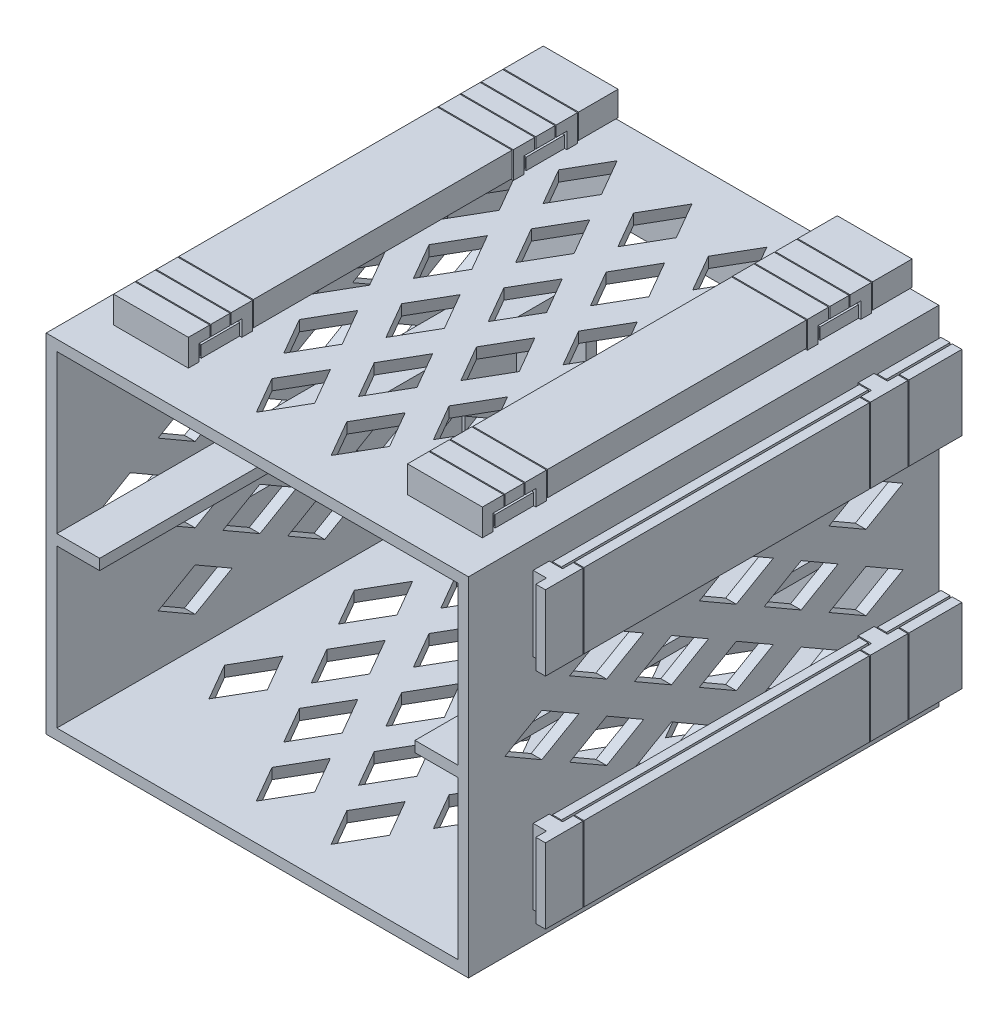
SolidWorks part; units mm, degrees
ref_plane "Alzado" through (0, 0, 0) normal (0, 0, 1) x (1, 0, 0)
ref_plane "Planta" through (0, 0, 0) normal (0, 1, 0) x (1, 0, 0)
ref_plane "Vista lateral" through (0, 0, 0) normal (1, 0, 0) x (0, 0, -1)
sketch "Croquis1" plane through (0, 0, 0) normal (0, 0, -1) x (-1, 0, 0)
  line L1 (-39.5, 32.5) -> (39.5, 32.5)
  line L2 (-39.5, 32.5) -> (-39.5, -32.5)
  line L3 (-39.5, -32.5) -> (39.5, -32.5)
  line L4 (39.5, 32.5) -> (39.5, -32.5)
  line L7 (-24.5, 17.5) -> (24.5, 17.5)
  line L8 (-24.5, 17.5) -> (-24.5, -17.5)
  line L9 (-24.5, -17.5) -> (24.5, -17.5)
  line L10 (24.5, 17.5) -> (24.5, -17.5)
extrude "Fondo" add sketch "Croquis1" against normal blind 2 separate body
sketch "Croquis3" plane through (0, 0, 2) normal (0, 0, 1) x (1, 0, 0)
  line L1 (-39.5, 32.5) -> (39.5, 32.5)
  line L2 (-39.5, 32.5) -> (-39.5, -32.5)
  line L3 (-39.5, -32.5) -> (39.5, -32.5)
  line L4 (39.5, 32.5) -> (39.5, -32.5)
  line L6 (-37.5, 30.5) -> (-37.5, -30.5)
  line L7 (-37.5, 30.5) -> (37.5, 30.5)
  line L8 (37.5, 30.5) -> (37.5, -30.5)
  line L9 (-37.5, -30.5) -> (37.5, -30.5)
extrude "Estructura" add sketch "Croquis3" along normal blind 86
sketch "Croquis5" plane through (-39.5, 0, 0) normal (-1, 0, 0) x (0, 0, 1)
  line L0 (13.628, 25) -> (20.556, 21)
  line L1 (20.556, 21) -> (13.628, 17)
  line L2 (13.628, 17) -> (6.7, 21)
  line L3 (6.7, 21) -> (13.628, 25)
  line L4 (0, -32.5) -> (0, 32.5) construction
  line L5 (88, 32.5) -> (0, 32.5) construction
  line L6 (13.628, 11) -> (20.556, 7)
  line L7 (6.7, 7) -> (13.628, 11)
  line L8 (13.628, 3) -> (6.7, 7)
  line L9 (20.556, 7) -> (13.628, 3)
  line L10 (13.628, -3) -> (20.556, -7)
  line L11 (6.7, -7) -> (13.628, -3)
  line L12 (13.628, -11) -> (6.7, -7)
  line L13 (20.556, -7) -> (13.628, -11)
  line L14 (13.628, -17) -> (20.556, -21)
  line L15 (6.7, -21) -> (13.628, -17)
  line L16 (13.628, -25) -> (6.7, -21)
  line L17 (20.556, -21) -> (13.628, -25)
  line L18 (37.884, 25) -> (44.812, 21)
  line L19 (44.812, 21) -> (37.884, 17)
  line L20 (37.884, 17) -> (30.956, 21)
  line L21 (30.956, 21) -> (37.884, 25)
  line L22 (44.812, 7) -> (37.884, 3)
  line L23 (37.884, 11) -> (44.812, 7)
  line L24 (30.956, 7) -> (37.884, 11)
  line L25 (37.884, 3) -> (30.956, 7)
  line L26 (44.812, -7) -> (37.884, -11)
  line L27 (37.884, -3) -> (44.812, -7)
  line L28 (30.956, -7) -> (37.884, -3)
  line L29 (37.884, -11) -> (30.956, -7)
  line L30 (37.884, -17) -> (44.812, -21)
  line L31 (44.812, -21) -> (37.884, -25)
  line L32 (37.884, -25) -> (30.956, -21)
  line L33 (30.956, -21) -> (37.884, -17)
  line L34 (62.14, 25) -> (69.068, 21)
  line L35 (69.068, 21) -> (62.14, 17)
  line L36 (62.14, 17) -> (55.212, 21)
  line L37 (55.212, 21) -> (62.14, 25)
  line L38 (69.068, 7) -> (62.14, 3)
  line L39 (62.14, 11) -> (69.068, 7)
  line L40 (55.212, 7) -> (62.14, 11)
  line L41 (62.14, 3) -> (55.212, 7)
  line L42 (69.068, -7) -> (62.14, -11)
  line L43 (62.14, -3) -> (69.068, -7)
  line L44 (55.212, -7) -> (62.14, -3)
  line L45 (62.14, -11) -> (55.212, -7)
  line L46 (62.14, -17) -> (69.068, -21)
  line L47 (69.068, -21) -> (62.14, -25)
  line L48 (62.14, -25) -> (55.212, -21)
  line L49 (55.212, -21) -> (62.14, -17)
  line L66 (50.012, 18) -> (56.94, 14)
  line L67 (56.94, 14) -> (50.012, 10)
  line L68 (50.012, 10) -> (43.084, 14)
  line L69 (43.084, 14) -> (50.012, 18)
  line L70 (50.012, 4) -> (56.94, 0)
  line L71 (43.084, 0) -> (50.012, 4)
  line L72 (50.012, -4) -> (43.084, 0)
  line L73 (56.94, -14) -> (50.012, -18)
  line L74 (50.012, -10) -> (56.94, -14)
  line L75 (43.084, -14) -> (50.012, -10)
  line L76 (18.828, 14) -> (25.756, 18)
  line L77 (67.34, 14) -> (74.268, 18) construction
  line L78 (67.34, -14) -> (74.268, -10) construction
  line L79 (74.268, -18) -> (67.34, -14) construction
  line L80 (25.756, 4) -> (32.684, 0)
  line L81 (18.828, 0) -> (25.756, 4)
  line L82 (25.756, -4) -> (18.828, 0)
  line L83 (32.684, 0) -> (25.756, -4)
  line L84 (25.756, -18) -> (18.828, -14)
  line L85 (32.684, -14) -> (25.756, -18)
  line L86 (56.94, 0) -> (50.012, -4)
  line L87 (50.012, -18) -> (43.084, -14)
  line L88 (32.684, 14) -> (25.756, 10)
  line L89 (25.756, 10) -> (18.828, 14)
  line L90 (25.756, 18) -> (32.684, 14)
  line L91 (74.268, 18) -> (81.196, 14) construction
  line L92 (81.196, 14) -> (74.268, 10) construction
  line L93 (74.268, 10) -> (67.34, 14) construction
  line L94 (81.196, 0) -> (74.268, -4)
  line L95 (74.268, 4) -> (81.196, 0)
  line L96 (67.34, 0) -> (74.268, 4)
  line L97 (74.268, -4) -> (67.34, 0)
  line L98 (81.196, -14) -> (74.268, -18) construction
  line L99 (74.268, -10) -> (81.196, -14) construction
  line L100 (25.756, -10) -> (32.684, -14)
  line L101 (18.828, -14) -> (25.756, -10)
  line L102 (88, 32.5) -> (0, 32.5) construction
  line L103 (86.396, 25) -> (93.324, 21)
  line L104 (93.324, 21) -> (86.396, 17)
  line L105 (86.396, 17) -> (79.468, 21)
  line L106 (79.468, 21) -> (86.396, 25)
  line L107 (93.324, 7) -> (86.396, 3)
  line L108 (86.396, 11) -> (93.324, 7)
  line L109 (79.468, 7) -> (86.396, 11)
  line L110 (86.396, 3) -> (79.468, 7)
  line L111 (93.324, -7) -> (86.396, -11)
  line L112 (86.396, -3) -> (93.324, -7)
  line L113 (79.468, -7) -> (86.396, -3)
  line L114 (86.396, -11) -> (79.468, -7)
  line L115 (86.396, -17) -> (93.324, -21)
  line L116 (93.324, -21) -> (86.396, -25)
  line L117 (86.396, -25) -> (79.468, -21)
  line L118 (79.468, -21) -> (86.396, -17)
  dimension "D1" = 7.9998
  dimension "D2" = 7.9998
  dimension "D3" = 6.7
  dimension "D4" = 7.5
  dimension "D5" = 8
  dimension "D7" = 13.856
  dimension "D9" = 24.256
  dimension "D10" = 14.5
  dimension "D11" = 24.256
  dimension "D6" = 4
  dimension "D8" = 4
extrude "RombosHor" cut sketch "Croquis5" against normal up to surface (79 mm away)
sketch "Croquis9" plane through (0, 32.5, 0) normal (0, 1, 0) x (1, 0, 0)
  line L0 (28, -6.6872) -> (24, -13.6154)
  line L1 (28, -6.6872) -> (32, -13.6154)
  line L2 (24, -13.6154) -> (28, -20.5436)
  line L3 (32, -13.6154) -> (28, -20.5436)
  line L4 (14, -6.6872) -> (10, -13.6154)
  line L5 (14, -6.6872) -> (18, -13.6154)
  line L6 (18, -13.6154) -> (14, -20.5436)
  line L7 (10, -13.6154) -> (14, -20.5436)
  line L8 (0, -6.6872) -> (-4, -13.6154)
  line L9 (0, -6.6872) -> (4, -13.6154)
  line L10 (4, -13.6154) -> (0, -20.5436)
  line L11 (-4, -13.6154) -> (0, -20.5436)
  line L12 (-14, -6.6872) -> (-18, -13.6154)
  line L13 (-14, -6.6872) -> (-10, -13.6154)
  line L14 (-10, -13.6154) -> (-14, -20.5436)
  line L15 (-18, -13.6154) -> (-14, -20.5436)
  line L16 (-28, -6.6872) -> (-32, -13.6154)
  line L17 (-28, -6.6872) -> (-24, -13.6154)
  line L18 (-24, -13.6154) -> (-28, -20.5436)
  line L19 (-32, -13.6154) -> (-28, -20.5436)
  line L20 (14, -30.9436) -> (10, -37.8718)
  line L21 (14, -30.9436) -> (18, -37.8718)
  line L22 (18, -37.8718) -> (14, -44.8)
  line L23 (10, -37.8718) -> (14, -44.8)
  line L24 (0, -30.9436) -> (-4, -37.8718)
  line L25 (0, -30.9436) -> (4, -37.8718)
  line L26 (4, -37.8718) -> (0, -44.8)
  line L27 (-4, -37.8718) -> (0, -44.8)
  line L28 (-14, -30.9436) -> (-18, -37.8718)
  line L29 (-14, -30.9436) -> (-10, -37.8718)
  line L30 (-10, -37.8718) -> (-14, -44.8)
  line L31 (-18, -37.8718) -> (-14, -44.8)
  line L32 (-28, -30.9436) -> (-32, -37.8718)
  line L33 (-28, -30.9436) -> (-24, -37.8718)
  line L34 (-24, -37.8718) -> (-28, -44.8)
  line L35 (-32, -37.8718) -> (-28, -44.8)
  line L36 (14, -55.2) -> (10, -62.1282)
  line L37 (14, -55.2) -> (18, -62.1282)
  line L38 (18, -62.1282) -> (14, -69.0564)
  line L39 (10, -62.1282) -> (14, -69.0564)
  line L40 (0, -55.2) -> (-4, -62.1282)
  line L41 (0, -55.2) -> (4, -62.1282)
  line L42 (4, -62.1282) -> (0, -69.0564)
  line L43 (-4, -62.1282) -> (0, -69.0564)
  line L44 (-14, -55.2) -> (-18, -62.1282)
  line L45 (-14, -55.2) -> (-10, -62.1282)
  line L46 (-10, -62.1282) -> (-14, -69.0564)
  line L47 (-18, -62.1282) -> (-14, -69.0564)
  line L48 (-28, -55.2) -> (-32, -62.1282)
  line L49 (-28, -55.2) -> (-24, -62.1282)
  line L50 (-24, -62.1282) -> (-28, -69.0564)
  line L51 (-32, -62.1282) -> (-28, -69.0564)
  line L68 (28, -30.9436) -> (24, -37.8718)
  line L69 (28, -30.9436) -> (32, -37.8718)
  line L70 (32, -37.8718) -> (28, -44.8)
  line L71 (24, -37.8718) -> (28, -44.8)
  line L72 (28, -55.2) -> (24, -62.1282)
  line L73 (28, -55.2) -> (32, -62.1282)
  line L74 (32, -62.1282) -> (28, -69.0564)
  line L75 (24, -62.1282) -> (28, -69.0564)
  line L80 (28, -6.6872) -> (14, -6.6872) construction
  line L81 (28, -6.6872) -> (28, -30.9436) construction
  line L83 (39.5, -88) -> (39.5, 0) construction
  line L87 (-39.5, 0) -> (39.5, 0) construction
  line L88 (17, -50.0018) -> (21, -56.93)
  line L89 (7, -67.33) -> (11, -74.2582)
  line L90 (-7, -67.33) -> (-11, -74.2582)
  line L91 (-7, -67.33) -> (-3, -74.2582)
  line L92 (-3, -74.2582) -> (-7, -81.1864)
  line L93 (-21, -67.33) -> (-25, -74.2582) construction
  line L94 (-21, -67.33) -> (-17, -74.2582) construction
  line L95 (-25, -74.2582) -> (-21, -81.1864) construction
  line L96 (21, -67.33) -> (25, -74.2582) construction
  line L97 (25, -74.2582) -> (21, -81.1864) construction
  line L98 (17, -74.2582) -> (21, -81.1864) construction
  line L99 (7, -18.8172) -> (3, -25.7454)
  line L100 (17, -25.7454) -> (21, -32.6736)
  line L101 (21, -18.8172) -> (25, -25.7454)
  line L102 (-7, -43.0736) -> (-11, -50.0018)
  line L103 (-3, -50.0018) -> (-7, -56.93)
  line L104 (-21, -43.0736) -> (-25, -50.0018)
  line L105 (-21, -43.0736) -> (-17, -50.0018)
  line L106 (-3, -25.7454) -> (-7, -32.6736)
  line L107 (-11, -25.7454) -> (-7, -32.6736)
  line L108 (-21, -18.8172) -> (-17, -25.7454)
  line L109 (-21, -18.8172) -> (-25, -25.7454)
  line L110 (-25, -25.7454) -> (-21, -32.6736)
  line L111 (21, -43.0736) -> (17, -50.0018)
  line L112 (11, -25.7454) -> (7, -32.6736)
  line L113 (7, -18.8172) -> (11, -25.7454)
  line L114 (7, -67.33) -> (3, -74.2582)
  line L115 (11, -74.2582) -> (7, -81.1864)
  line L116 (3, -74.2582) -> (7, -81.1864)
  line L117 (-11, -74.2582) -> (-7, -81.1864)
  line L118 (-17, -74.2582) -> (-21, -81.1864) construction
  line L119 (21, -67.33) -> (17, -74.2582) construction
  line L120 (7, -43.0736) -> (3, -50.0018)
  line L121 (7, -43.0736) -> (11, -50.0018)
  line L122 (11, -50.0018) -> (7, -56.93)
  line L123 (3, -50.0018) -> (7, -56.93)
  line L124 (21, -43.0736) -> (25, -50.0018)
  line L125 (25, -50.0018) -> (21, -56.93)
  line L126 (21, -18.8172) -> (17, -25.7454)
  line L127 (-7, -43.0736) -> (-3, -50.0018)
  line L128 (-11, -50.0018) -> (-7, -56.93)
  line L129 (-17, -50.0018) -> (-21, -56.93)
  line L130 (-25, -50.0018) -> (-21, -56.93)
  line L131 (-7, -18.8172) -> (-11, -25.7454)
  line L132 (-7, -18.8172) -> (-3, -25.7454)
  line L133 (-17, -25.7454) -> (-21, -32.6736)
  line L134 (3, -25.7454) -> (7, -32.6736)
  line L135 (25, -25.7454) -> (21, -32.6736)
  line L136 (18, -86.3846) -> (14, -93.3128)
  line L137 (10, -86.3846) -> (14, -93.3128)
  line L138 (4, -86.3846) -> (0, -93.3128)
  line L139 (-4, -86.3846) -> (0, -93.3128)
  line L140 (-10, -86.3846) -> (-14, -93.3128)
  line L141 (-18, -86.3846) -> (-14, -93.3128)
  line L142 (-24, -86.3846) -> (-28, -93.3128)
  line L143 (-32, -86.3846) -> (-28, -93.3128)
  line L144 (32, -86.3846) -> (28, -93.3128)
  line L145 (24, -86.3846) -> (28, -93.3128)
  line L146 (14, -79.4564) -> (10, -86.3846)
  line L147 (14, -79.4564) -> (18, -86.3846)
  line L148 (0, -79.4564) -> (-4, -86.3846)
  line L149 (0, -79.4564) -> (4, -86.3846)
  line L150 (-14, -79.4564) -> (-18, -86.3846)
  line L151 (-14, -79.4564) -> (-10, -86.3846)
  line L152 (-28, -79.4564) -> (-32, -86.3846)
  line L153 (-28, -79.4564) -> (-24, -86.3846)
  line L154 (28, -79.4564) -> (24, -86.3846)
  line L155 (28, -79.4564) -> (32, -86.3846)
  dimension "D1" = 8
  dimension "D2" = 8
  dimension "D3" = 8
  dimension "D4" = 13.8564
  dimension "D7" = 14
  dimension "D8" = 24.2564
  dimension "D9" = 6.6872
  dimension "D10" = 7.5
  dimension "D5" = 5
  dimension "D6" = 4
extrude "RombosVert" cut sketch "Croquis9" against normal up to surface (65 mm away)
sketch "Croquis8" plane through (0, 0, 2) normal (0, 0, 1) x (1, 0, 0)
  line L0 (-37.5, -30.5) -> (37.5, -30.5) construction
  line L1 (-29.5, -1) -> (-37.5, -1)
  line L2 (-29.5, -1) -> (-29.5, 1)
  line L3 (-29.5, 1) -> (-37.5, 1)
  line L4 (-37.5, -1) -> (-37.5, 1)
  line L5 (29.5, 1) -> (37.5, 1)
  line L6 (29.5, 1) -> (29.5, -1)
  line L7 (29.5, -1) -> (37.5, -1)
  line L8 (37.5, 1) -> (37.5, -1)
  dimension "D1" = 8
  dimension "D2" = 2
  dimension "D3" = 29.5
extrude "Guias" add sketch "Croquis8" along normal blind 86
sketch "Croquis10" plane through (39.5, 0, 0) normal (1, 0, 0) x (0, 0, -1)
  line L0 (-88, 32.5) -> (0, 32.5) construction
  line L1 (-12.104, -27.5) -> (-12.104, -13.5)
  line L2 (-15.104, -13.5) -> (-12.104, -13.5)
  line L3 (-15.104, -27.5) -> (-15.104, -13.5)
  line L4 (-15.104, -27.5) -> (-12.104, -27.5)
  line L5 (-88, 0) -> (0, 0) construction
  line L6 (-75.896, 27.5) -> (-75.896, 13.5)
  line L7 (-72.896, 13.5) -> (-75.896, 13.5)
  line L8 (-72.896, 27.5) -> (-72.896, 13.5)
  line L9 (0, 32.5) -> (0, -32.5) construction
  line L11 (-44, -32.5) -> (-44, 32.5) construction
  line L12 (-15.104, 27.5) -> (-12.104, 27.5)
  line L13 (-15.104, 27.5) -> (-15.104, 13.5)
  line L14 (-15.104, 13.5) -> (-12.104, 13.5)
  line L15 (-12.104, 27.5) -> (-12.104, 13.5)
  line L16 (-72.896, 27.5) -> (-75.896, 27.5)
  line L17 (-72.896, -27.5) -> (-75.896, -27.5)
  line L18 (-72.896, -27.5) -> (-72.896, -13.5)
  line L19 (-72.896, -13.5) -> (-75.896, -13.5)
  line L20 (-75.896, -27.5) -> (-75.896, -13.5)
  line L21 (-88, -32.5) -> (0, -32.5) construction
  dimension "D1" = 44
  dimension "D2" = 32.5
  dimension "D6" = 3
  dimension "D7" = 14
  dimension "D8" = 5
  dimension "D9" = 12.104
extrude "AncDer01" add sketch "Croquis10" along normal blind 2.5
sketch "Croquis11" plane through (42, 0, 0) normal (1, 0, 0) x (0, 0, -1)
  line L0 (-15.104, 13.5) -> (-12.104, 13.5) construction
  line L1 (0, 32.5) -> (0, -32.5) construction
  line L2 (-15.104, 27.5) -> (-15.104, 24.1478) construction
  line L3 (-17.104, 27.5) -> (-10.104, 27.5)
  line L4 (-17.104, 27.5) -> (-17.104, 13.5)
  line L5 (-44, 32.5) -> (-44, -32.5) construction
  line L6 (-12.104, 27.5) -> (-15.104, 27.5) construction
  line L7 (-10.104, -27.5) -> (-10.104, -13.5)
  line L8 (-17.104, 13.5) -> (-10.104, 13.5)
  line L9 (-17.104, -13.5) -> (-10.104, -13.5)
  line L10 (-88, 0) -> (0, 0) construction
  line L11 (-10.104, 27.5) -> (-10.104, 13.5)
  line L12 (-17.104, -27.5) -> (-17.104, -13.5)
  line L13 (-17.104, -27.5) -> (-10.104, -27.5)
  line L14 (-70.896, -27.5) -> (-77.896, -27.5)
  line L15 (-70.896, -27.5) -> (-70.896, -13.5)
  line L16 (-77.896, 27.5) -> (-77.896, 13.5)
  line L17 (-70.896, -13.5) -> (-77.896, -13.5)
  line L18 (-70.896, 13.5) -> (-77.896, 13.5)
  line L19 (-77.896, -27.5) -> (-77.896, -13.5)
  line L20 (-70.896, 27.5) -> (-70.896, 13.5)
  line L21 (-70.896, 27.5) -> (-77.896, 27.5)
  dimension "D1" = 44
  dimension "D2" = 88
  dimension "D3" = 7
  dimension "D4" = 2
extrude "AncDer02" add sketch "Croquis11" along normal blind 1.8
sketch "Croquis12" plane through (0, 32.5, 0) normal (0, 1, 0) x (1, 0, 0)
  line L1 (20.5, -9.604) -> (20.5, -7.604)
  line L2 (34.5, -7.604) -> (20.5, -7.604)
  line L3 (34.5, -9.604) -> (34.5, -7.604)
  line L4 (34.5, -9.604) -> (20.5, -9.604)
  line L5 (20.5, -19.604) -> (20.5, -17.604)
  line L6 (34.5, -17.604) -> (20.5, -17.604)
  line L7 (34.5, -19.604) -> (34.5, -17.604)
  line L8 (34.5, -19.604) -> (20.5, -19.604)
  line L10 (39.5, -44) -> (-39.5, -44) construction
  line L11 (-20.5, -78.396) -> (-20.5, -80.396)
  line L12 (-34.5, -80.396) -> (-20.5, -80.396)
  line L13 (0, -88) -> (0, 0) construction
  line L14 (-34.5, -78.396) -> (-34.5, -80.396)
  line L15 (-34.5, -78.396) -> (-20.5, -78.396)
  line L16 (-20.5, -68.396) -> (-20.5, -70.396)
  line L17 (-34.5, -70.396) -> (-20.5, -70.396)
  line L18 (-34.5, -68.396) -> (-34.5, -70.396)
  line L19 (-34.5, -68.396) -> (-20.5, -68.396)
  line L20 (34.5, -68.396) -> (20.5, -68.396)
  line L21 (-34.5, -19.604) -> (-20.5, -19.604)
  line L22 (-34.5, -19.604) -> (-34.5, -17.604)
  line L23 (-34.5, -17.604) -> (-20.5, -17.604)
  line L24 (-20.5, -19.604) -> (-20.5, -17.604)
  line L25 (-34.5, -9.604) -> (-20.5, -9.604)
  line L26 (-34.5, -9.604) -> (-34.5, -7.604)
  line L27 (-34.5, -7.604) -> (-20.5, -7.604)
  line L28 (-20.5, -9.604) -> (-20.5, -7.604)
  line L29 (34.5, -68.396) -> (34.5, -70.396)
  line L30 (34.5, -70.396) -> (20.5, -70.396)
  line L31 (20.5, -68.396) -> (20.5, -70.396)
  line L32 (34.5, -78.396) -> (20.5, -78.396)
  line L33 (34.5, -78.396) -> (34.5, -80.396)
  line L34 (34.5, -80.396) -> (20.5, -80.396)
  line L35 (20.5, -78.396) -> (20.5, -80.396)
  line L38 (-39.5, 0) -> (39.5, 0) construction
  line L39 (-39.5, -88) -> (-39.5, 0) construction
  dimension "D9" = 88
  dimension "D10" = 44
  dimension "D11" = 2
  dimension "D12" = 2
  dimension "D13" = 14
  dimension "D14" = 14
  dimension "D15" = 5
  dimension "D16" = 5
  dimension "D17" = 7.604
  dimension "D18" = 8
extrude "AncSup01" add sketch "Croquis12" along normal blind 3
sketch "Croquis13" plane through (0, 35.5, 0) normal (0, 1, 0) x (1, 0, 0)
  line L0 (39.5, -44) -> (-39.5, -44) construction
  line L2 (-39.5, 0) -> (39.5, 0) construction
  line L3 (-20.5, -9.604) -> (-20.5, -7.604) construction
  line L4 (-34.5, -7.604) -> (-20.5, -7.604)
  line L5 (-34.5, -7.604) -> (-34.5, -11.604)
  line L6 (-34.5, -11.604) -> (-20.5, -11.604)
  line L7 (-20.5, -7.604) -> (-20.5, -11.604)
  line L8 (-27.4575, -19.604) -> (-21.4543, -19.604) construction
  line L10 (-34.5, -19.604) -> (-20.5, -19.604)
  line L11 (0, 0) -> (0, -88) construction
  line L13 (-34.5, -19.604) -> (-34.5, -15.604)
  line L14 (-34.5, -15.604) -> (-20.5, -15.604)
  line L15 (-20.5, -19.604) -> (-20.5, -15.604)
  line L16 (-20.5, -19.604) -> (-20.5, -17.604) construction
  line L17 (20.5, -19.604) -> (20.5, -15.604)
  line L18 (34.5, -15.604) -> (20.5, -15.604)
  line L19 (34.5, -19.604) -> (34.5, -15.604)
  line L20 (34.5, -19.604) -> (20.5, -19.604)
  line L21 (20.5, -7.604) -> (20.5, -11.604)
  line L22 (34.5, -11.604) -> (20.5, -11.604)
  line L23 (34.5, -7.604) -> (34.5, -11.604)
  line L24 (34.5, -7.604) -> (20.5, -7.604)
  line L25 (34.5, -80.396) -> (20.5, -80.396)
  line L26 (34.5, -80.396) -> (34.5, -76.396)
  line L27 (34.5, -76.396) -> (20.5, -76.396)
  line L28 (20.5, -80.396) -> (20.5, -76.396)
  line L29 (34.5, -68.396) -> (20.5, -68.396)
  line L30 (34.5, -68.396) -> (34.5, -72.396)
  line L31 (34.5, -72.396) -> (20.5, -72.396)
  line L32 (20.5, -68.396) -> (20.5, -72.396)
  line L33 (-20.5, -68.396) -> (-20.5, -72.396)
  line L34 (-34.5, -72.396) -> (-20.5, -72.396)
  line L35 (-34.5, -68.396) -> (-34.5, -72.396)
  line L36 (-34.5, -68.396) -> (-20.5, -68.396)
  line L37 (-20.5, -80.396) -> (-20.5, -76.396)
  line L38 (-34.5, -76.396) -> (-20.5, -76.396)
  line L39 (-34.5, -80.396) -> (-34.5, -76.396)
  line L40 (-34.5, -80.396) -> (-20.5, -80.396)
  dimension "D1" = 44
  dimension "D2" = 88
  dimension "D3" = 4
  dimension "D4" = 4
extrude "AncSup02" add sketch "Croquis13" along normal blind 2
sketch "Croquis52" plane through (-39.5, 0, 0) normal (-1, 0, 0) x (0, 0, 1)
  line L0 (0, -32.5) -> (0, 32.5) construction
  line L1 (88, 32.5) -> (0, 32.5) construction
  line L2 (9.604, -27.5) -> (7.604, -27.5)
  line L3 (9.604, -27.5) -> (9.604, -13.5)
  line L4 (9.604, -13.5) -> (7.604, -13.5)
  line L5 (7.604, -27.5) -> (7.604, -13.5)
  line L6 (19.604, -27.5) -> (17.604, -27.5)
  line L7 (19.604, -27.5) -> (19.604, -13.5)
  line L8 (19.604, -13.5) -> (17.604, -13.5)
  line L9 (44, 32.5) -> (44, -32.5) construction
  line L10 (17.604, -27.5) -> (17.604, -13.5)
  line L11 (78.396, 27.5) -> (80.396, 27.5)
  line L12 (78.396, 27.5) -> (78.396, 13.5)
  line L13 (78.396, 13.5) -> (80.396, 13.5)
  line L14 (80.396, 27.5) -> (80.396, 13.5)
  line L15 (68.396, 27.5) -> (70.396, 27.5)
  line L16 (88, 0) -> (0, 0) construction
  line L17 (68.396, 27.5) -> (68.396, 13.5)
  line L18 (68.396, 13.5) -> (70.396, 13.5)
  line L19 (70.396, 27.5) -> (70.396, 13.5)
  line L20 (70.396, -27.5) -> (70.396, -13.5)
  line L21 (68.396, -13.5) -> (70.396, -13.5)
  line L22 (68.396, -27.5) -> (68.396, -13.5)
  line L23 (68.396, -27.5) -> (70.396, -27.5)
  line L24 (80.396, -27.5) -> (80.396, -13.5)
  line L25 (78.396, -13.5) -> (80.396, -13.5)
  line L26 (78.396, -27.5) -> (78.396, -13.5)
  line L27 (78.396, -27.5) -> (80.396, -27.5)
  line L32 (17.604, 27.5) -> (17.604, 13.5)
  line L33 (19.604, 13.5) -> (17.604, 13.5)
  line L34 (19.604, 27.5) -> (19.604, 13.5)
  line L35 (19.604, 27.5) -> (17.604, 27.5)
  line L36 (7.604, 27.5) -> (7.604, 13.5)
  line L37 (9.604, 13.5) -> (7.604, 13.5)
  line L38 (9.604, 27.5) -> (9.604, 13.5)
  line L39 (9.604, 27.5) -> (7.604, 27.5)
  dimension "D1" = 44
  dimension "D2" = 88
  dimension "D3" = 2
  dimension "D4" = 2
  dimension "D5" = 8
  dimension "D6" = 14
  dimension "D7" = 14
  dimension "D8" = 7.604
  dimension "D9" = 5
  dimension "D10" = 5
extrude "AncIzq01" add sketch "Croquis52" along normal blind 3
sketch "Croquis53" plane through (-42.5, 0, 0) normal (-1, 0, 0) x (0, 0, 1)
  line L0 (44, 32.5) -> (44, -32.5) construction
  line L1 (0, -32.5) -> (0, 32.5) construction
  line L2 (7.604, 13.5) -> (9.604, 13.5) construction
  line L3 (7.604, 27.5) -> (11.604, 27.5)
  line L4 (7.604, 27.5) -> (7.604, 13.5)
  line L5 (7.604, 13.5) -> (11.604, 13.5)
  line L6 (11.604, 27.5) -> (11.604, 13.5)
  line L7 (17.604, 13.5) -> (19.604, 13.5) construction
  line L8 (19.604, 27.5) -> (15.604, 27.5)
  line L10 (19.604, 27.5) -> (19.604, 13.5)
  line L12 (88, 0) -> (0, 0) construction
  line L13 (19.604, 13.5) -> (15.604, 13.5)
  line L14 (15.604, 27.5) -> (15.604, 13.5)
  line L15 (15.604, -27.5) -> (15.604, -13.5)
  line L16 (19.604, -13.5) -> (15.604, -13.5)
  line L17 (19.604, -27.5) -> (19.604, -13.5)
  line L18 (19.604, -27.5) -> (15.604, -27.5)
  line L19 (11.604, -27.5) -> (11.604, -13.5)
  line L20 (7.604, -13.5) -> (11.604, -13.5)
  line L21 (7.604, -27.5) -> (7.604, -13.5)
  line L22 (7.604, -27.5) -> (11.604, -27.5)
  line L23 (80.396, -27.5) -> (76.396, -27.5)
  line L24 (80.396, -27.5) -> (80.396, -13.5)
  line L25 (80.396, -13.5) -> (76.396, -13.5)
  line L26 (76.396, -27.5) -> (76.396, -13.5)
  line L27 (68.396, -27.5) -> (72.396, -27.5)
  line L28 (68.396, -27.5) -> (68.396, -13.5)
  line L29 (68.396, -13.5) -> (72.396, -13.5)
  line L30 (72.396, -27.5) -> (72.396, -13.5)
  line L31 (72.396, 27.5) -> (72.396, 13.5)
  line L32 (68.396, 13.5) -> (72.396, 13.5)
  line L33 (68.396, 27.5) -> (68.396, 13.5)
  line L34 (68.396, 27.5) -> (72.396, 27.5)
  line L35 (76.396, 27.5) -> (76.396, 13.5)
  line L36 (80.396, 13.5) -> (76.396, 13.5)
  line L37 (80.396, 27.5) -> (80.396, 13.5)
  line L38 (80.396, 27.5) -> (76.396, 27.5)
  dimension "D1" = 44
  dimension "D2" = 88
  dimension "D3" = 4
  dimension "D4" = 4
extrude "AncIzq02" add sketch "Croquis53" along normal blind 2
sketch "Croquis54" plane through (0, -32.5, 0) normal (0, -1, 0) x (1, 0, 0)
  line L0 (0, 88) -> (0, 0) construction
  line L1 (-34.5, 15.104) -> (-20.5, 15.104)
  line L2 (-34.5, 15.104) -> (-34.5, 12.104)
  line L3 (-34.5, 12.104) -> (-20.5, 12.104)
  line L4 (-20.5, 15.104) -> (-20.5, 12.104)
  line L5 (-39.5, 88) -> (39.5, 88) construction
  line L6 (-39.5, 44) -> (39.5, 44) construction
  line L7 (-39.5, 88) -> (-39.5, 0) construction
  line L8 (39.5, 88) -> (39.5, 0) construction
  line L9 (39.5, 0) -> (-39.5, 0) construction
  line L10 (20.5, 15.104) -> (20.5, 12.104)
  line L11 (34.5, 12.104) -> (20.5, 12.104)
  line L12 (34.5, 15.104) -> (34.5, 12.104)
  line L13 (34.5, 15.104) -> (20.5, 15.104)
  line L14 (34.5, 72.896) -> (20.5, 72.896)
  line L15 (34.5, 72.896) -> (34.5, 75.896)
  line L16 (34.5, 75.896) -> (20.5, 75.896)
  line L17 (20.5, 72.896) -> (20.5, 75.896)
  line L18 (-20.5, 72.896) -> (-20.5, 75.896)
  line L19 (-34.5, 75.896) -> (-20.5, 75.896)
  line L20 (-34.5, 72.896) -> (-34.5, 75.896)
  line L21 (-34.5, 72.896) -> (-20.5, 72.896)
  dimension "D1" = 3
  dimension "D2" = 14
  dimension "D3" = 5
  dimension "D4" = 12.104
extrude "AncInf01" [suppressed] add sketch "Croquis54" along normal blind 2.5
sketch "Croquis55" [suppressed] plane through (0, -35, 0) normal (0, -1, 0) x (1, 0, 0)
  line L1 (-34.5, 77.896) -> (-20.5, 77.896)
  line L2 (-34.5, 77.896) -> (-34.5, 70.896)
  line L3 (-34.5, 70.896) -> (-20.5, 70.896)
  line L4 (-20.5, 77.896) -> (-20.5, 70.896)
  line L6 (-20.5, 72.896) -> (-20.5, 75.896) construction
  line L7 (-34.5, 75.896) -> (-34.5, 72.896) construction
  line L8 (-34.5, 72.896) -> (-20.5, 72.896) construction
  line L9 (-39.5, 44) -> (39.5, 44) construction
  line L10 (-39.5, 88) -> (-39.5, 0) construction
  line L11 (39.5, 88) -> (39.5, 0) construction
  line L12 (0, 88) -> (0, 0) construction
  line L13 (-39.5, 88) -> (39.5, 88) construction
  line L14 (20.5, 77.896) -> (20.5, 70.896)
  line L15 (34.5, 70.896) -> (20.5, 70.896)
  line L16 (34.5, 77.896) -> (34.5, 70.896)
  line L17 (34.5, 77.896) -> (20.5, 77.896)
  line L18 (34.5, 10.104) -> (20.5, 10.104)
  line L19 (34.5, 10.104) -> (34.5, 17.104)
  line L20 (34.5, 17.104) -> (20.5, 17.104)
  line L21 (20.5, 10.104) -> (20.5, 17.104)
  line L22 (-20.5, 10.104) -> (-20.5, 17.104)
  line L23 (-34.5, 17.104) -> (-20.5, 17.104)
  line L24 (-34.5, 10.104) -> (-34.5, 17.104)
  line L25 (-34.5, 10.104) -> (-20.5, 10.104)
  dimension "D1" = 7
  dimension "D2" = 2
extrude "AncInf02" [suppressed] add sketch "Croquis55" along normal blind 1.8
sketch "Croquis61" plane through (0, 0, 0) normal (0, 0, -1) x (-1, 0, 0)
  line L1 (20.5, 32.9) -> (34.5, 32.9)
  line L2 (20.5, 32.9) -> (20.5, 37.5)
  line L3 (20.5, 37.5) -> (34.5, 37.5)
  line L4 (34.5, 32.9) -> (34.5, 37.5)
  line L5 (20.7, 33.1) -> (20.7, 37.3)
  line L6 (20.7, 37.3) -> (34.3, 37.3)
  line L7 (34.3, 33.1) -> (34.3, 37.3)
  line L8 (20.7, 33.1) -> (34.3, 33.1)
  line L9 (0, 32.5) -> (0, 17.5) construction
  line L10 (39.5, 32.5) -> (-39.5, 32.5) construction
  line L11 (24.5, 17.5) -> (-24.5, 17.5) construction
  line L12 (-20.7, 33.1) -> (-34.3, 33.1)
  line L13 (-34.3, 33.1) -> (-34.3, 37.3)
  line L14 (-20.7, 37.3) -> (-34.3, 37.3)
  line L15 (-20.7, 33.1) -> (-20.7, 37.3)
  line L16 (-34.5, 32.9) -> (-34.5, 37.5)
  line L17 (-20.5, 37.5) -> (-34.5, 37.5)
  line L18 (-20.5, 32.9) -> (-20.5, 37.5)
  line L19 (-20.5, 32.9) -> (-34.5, 32.9)
  dimension "D1" = 0.2
extrude "EspAncSup01" add sketch "Croquis61" against normal blind 7.404 separate body
ref_plane "PlanoEspAncSup01" through (0, 0, 19.804) normal (0, 0, 1) x (1, 0, 0)
sketch "Croquis57" plane through (0, 0, 19.804) normal (0, 0, 1) x (1, 0, 0)
  line L1 (34.5, 37.5) -> (20.5457, 37.5)
  line L2 (34.5, 37.5) -> (34.5, 32.9)
  line L3 (34.5, 32.9) -> (20.5457, 32.9)
  line L4 (20.5457, 37.5) -> (20.5457, 32.9)
  line L5 (34.3, 37.3) -> (34.3, 33.1)
  line L6 (34.3, 33.1) -> (20.7457, 33.1)
  line L7 (20.7457, 37.3) -> (20.7457, 33.1)
  line L8 (34.3, 37.3) -> (20.7457, 37.3)
  line L9 (0, 32.5) -> (0, 17.5) construction
  line L10 (-24.5, 17.5) -> (24.5, 17.5) construction
  line L11 (-34.3, 37.3) -> (-20.7457, 37.3)
  line L12 (-20.7457, 37.3) -> (-20.7457, 33.1)
  line L13 (-34.3, 33.1) -> (-20.7457, 33.1)
  line L14 (-34.3, 37.3) -> (-34.3, 33.1)
  line L15 (-20.5457, 37.5) -> (-20.5457, 32.9)
  line L16 (-34.5, 32.9) -> (-20.5457, 32.9)
  line L17 (-34.5, 37.5) -> (-34.5, 32.9)
  line L18 (-34.5, 37.5) -> (-20.5457, 37.5)
  dimension "D1" = 0.2
sketch "Croquis58" plane through (0, 0, 19.804) normal (0, 0, 1) x (1, 0, 0)
  line L0 (33.8, 36.8) -> (33.8, 33.6)
  line L1 (0, 32.5) -> (0, 17.5) construction
  line L2 (-33.6, 36.6) -> (-21.4457, 36.6)
  line L3 (-21.4457, 36.6) -> (-21.4457, 33.8)
  line L4 (-33.6, 33.8) -> (-21.4457, 33.8)
  line L5 (33.8, 33.6) -> (21.2457, 33.6)
  line L6 (21.2457, 36.8) -> (21.2457, 33.6)
  line L7 (33.8, 36.8) -> (21.2457, 36.8)
  line L8 (33.6, 36.6) -> (33.6, 33.8)
  line L9 (33.6, 33.8) -> (21.4457, 33.8)
  line L10 (21.4457, 36.6) -> (21.4457, 33.8)
  line L11 (33.6, 36.6) -> (21.4457, 36.6)
  line L12 (-33.6, 36.6) -> (-33.6, 33.8)
  line L13 (-33.8, 36.8) -> (-21.2457, 36.8)
  line L14 (-21.2457, 36.8) -> (-21.2457, 33.6)
  line L15 (-33.8, 33.6) -> (-21.2457, 33.6)
  line L16 (-33.8, 36.8) -> (-33.8, 33.6)
  dimension "D2" = 0.2
sketch "Croquis59" plane through (0, 0, 19.804) normal (0, 0, 1) x (1, 0, 0)
  line L0 (33.1, 36.1) -> (33.1, 34.3)
  line L1 (0, 32.5) -> (0, 17.5) construction
  line L2 (-32.9, 35.9) -> (-22.1457, 35.9)
  line L3 (-22.1457, 35.9) -> (-22.1457, 34.5)
  line L4 (-32.9, 34.5) -> (-22.1457, 34.5)
  line L5 (33.1, 34.3) -> (21.9457, 34.3)
  line L6 (21.9457, 36.1) -> (21.9457, 34.3)
  line L7 (33.1, 36.1) -> (21.9457, 36.1)
  line L8 (32.9, 35.9) -> (32.9, 34.5)
  line L9 (32.9, 34.5) -> (22.1457, 34.5)
  line L10 (22.1457, 35.9) -> (22.1457, 34.5)
  line L11 (32.9, 35.9) -> (22.1457, 35.9)
  line L12 (-32.9, 35.9) -> (-32.9, 34.5)
  line L13 (-33.1, 36.1) -> (-21.9457, 36.1)
  line L14 (-21.9457, 36.1) -> (-21.9457, 34.3)
  line L15 (-33.1, 34.3) -> (-21.9457, 34.3)
  line L16 (-33.1, 36.1) -> (-33.1, 34.3)
  dimension "D2" = 0.2
extrude "EspAncSup02" add sketch "Croquis57" along normal blind 48.392
extrude "EspAncSup03" add sketch "Croquis58" along normal blind 48.392 separate body
extrude "EspAncSup04" add sketch "Croquis59" along normal blind 48.392 separate body
ref_plane "PlanoEspAncSup02" through (0, 32.9, 0) normal (0, 1, 0) x (1, 0, 0)
sketch "Croquis64" plane through (0, 32.9, 0) normal (0, 1, 0) x (1, 0, 0)
  line L0 (-34.5, -9.604) -> (-29.684, -9.604) construction
  line L1 (-20.5, -17.204) -> (-34.5, -17.204)
  line L2 (-20.5, -17.204) -> (-20.5, -10.004)
  line L3 (-20.5, -10.004) -> (-34.5, -10.004)
  line L4 (-34.5, -17.204) -> (-34.5, -10.004)
  line L5 (-29.6972, -17.604) -> (-34.5, -17.604) construction
  line L6 (-34.5, -7.604) -> (-34.5, -9.604) construction
  line L7 (-39.5, -44) -> (39.5, -44) construction
  line L8 (-39.5, -88) -> (-39.5, 0) construction
  line L9 (39.5, -88) -> (39.5, 0) construction
  line L10 (0, 0) -> (0, -88) construction
  line L11 (39.5, -88) -> (-39.5, -88) construction
  line L12 (34.5, -17.204) -> (34.5, -10.004)
  line L13 (20.5, -10.004) -> (34.5, -10.004)
  line L14 (20.5, -17.204) -> (20.5, -10.004)
  line L15 (20.5, -17.204) -> (34.5, -17.204)
  line L16 (20.5, -70.796) -> (34.5, -70.796)
  line L17 (20.5, -70.796) -> (20.5, -77.996)
  line L18 (20.5, -77.996) -> (34.5, -77.996)
  line L19 (34.5, -70.796) -> (34.5, -77.996)
  line L20 (-34.5, -70.796) -> (-34.5, -77.996)
  line L21 (-20.5, -77.996) -> (-34.5, -77.996)
  line L22 (-20.5, -70.796) -> (-20.5, -77.996)
  line L23 (-20.5, -70.796) -> (-34.5, -70.796)
  dimension "D1" = 0.4
  dimension "D2" = 0.4
  dimension "D3" = 14
extrude "EspAncSup05" add sketch "Croquis64" along normal blind 2.2
sketch "Croquis66" plane through (0, 0, 17.204) normal (0, 0, 1) x (1, 0, 0)
  line L0 (-34.3, 34.9) -> (-34.3, 33.1)
  line L1 (0, 17.5) -> (0, 30.5) construction
  line L2 (-24.5, 17.5) -> (24.5, 17.5) construction
  line L3 (37.5, 30.5) -> (-37.5, 30.5) construction
  line L4 (34.3, 34.9) -> (20.7, 34.9)
  line L5 (-34.3, 33.1) -> (-20.7, 33.1)
  line L6 (-20.7, 34.9) -> (-20.7, 33.1)
  line L7 (-34.3, 34.9) -> (-20.7, 34.9)
  line L8 (20.7, 34.9) -> (20.7, 33.1)
  line L9 (34.3, 33.1) -> (20.7, 33.1)
  line L10 (34.3, 34.9) -> (34.3, 33.1)
extrude "EspAncSup06" cut sketch "Croquis66" against normal up to next (7.2 mm away)
sketch "Croquis68" plane through (0, 0, 77.996) normal (0, 0, 1) x (1, 0, 0)
  line L0 (34.3, 34.9) -> (34.3, 33.1)
  line L1 (0, 17.5) -> (0, 32.5) construction
  line L2 (-24.5, 17.5) -> (24.5, 17.5) construction
  line L3 (-34.3, 34.9) -> (-20.7, 34.9)
  line L4 (-20.7, 34.9) -> (-20.7, 33.1)
  line L5 (34.3, 33.1) -> (20.7, 33.1)
  line L6 (20.7, 34.9) -> (20.7, 33.1)
  line L7 (34.3, 34.9) -> (20.7, 34.9)
  line L8 (-34.3, 33.1) -> (-20.7, 33.1)
  line L9 (-34.3, 34.9) -> (-34.3, 33.1)
extrude "EspAncSup07" cut sketch "Croquis68" against normal up to next (7.2 mm away)
sketch "Croquis70" plane through (0, 35.5, 0) normal (0, -1, 0) x (1, 0, 0)
  line L1 (20.5, 70.396) -> (20.5, 72.396) construction
  line L2 (20.5, 72.396) -> (34.5, 72.396) construction
  line L3 (34.5, 76.396) -> (20.5, 76.396) construction
  line L4 (34.5, 72.396) -> (34.5, 70.396) construction
  line L5 (-34.5, 76.196) -> (-34.5, 72.596)
  line L6 (-20.5, 72.596) -> (-34.5, 72.596)
  line L7 (-20.5, 76.196) -> (-20.5, 72.596)
  line L8 (0, 88) -> (0, 0) construction
  line L9 (39.5, 88) -> (-39.5, 88) construction
  line L10 (39.5, 44) -> (-39.5, 44) construction
  line L11 (39.5, 88) -> (39.5, 0) construction
  line L12 (-39.5, 88) -> (-39.5, 0) construction
  line L13 (-20.5, 76.196) -> (-34.5, 76.196)
  line L14 (34.5, 11.804) -> (34.5, 15.404)
  line L15 (20.5, 15.404) -> (34.5, 15.404)
  line L16 (20.5, 11.804) -> (20.5, 15.404)
  line L17 (20.5, 76.196) -> (34.5, 76.196)
  line L18 (20.5, 76.196) -> (20.5, 72.596)
  line L19 (20.5, 72.596) -> (34.5, 72.596)
  line L20 (34.5, 76.196) -> (34.5, 72.596)
  line L21 (20.5, 11.804) -> (34.5, 11.804)
  line L22 (-20.5, 11.804) -> (-34.5, 11.804)
  line L23 (-20.5, 11.804) -> (-20.5, 15.404)
  line L24 (-20.5, 15.404) -> (-34.5, 15.404)
  line L25 (-34.5, 11.804) -> (-34.5, 15.404)
  dimension "D1" = 0.2
  dimension "D2" = 0.2
extrude "EspAncSup08" add sketch "Croquis70" against normal blind 2 separate body
sketch "Croquis71" plane through (0, 0, 72.596) normal (0, 0, -1) x (-1, 0, 0)
  line L0 (-34.3, 37.3) -> (-34.3, 35.7)
  line L2 (0, 32.5) -> (0, 17.5) construction
  line L3 (39.5, 32.5) -> (-39.5, 32.5) construction
  line L4 (24.5, 17.5) -> (-24.5, 17.5) construction
  line L5 (-20.7, 35.7) -> (-34.3, 35.7)
  line L6 (-20.7, 37.3) -> (-20.7, 35.7)
  line L7 (-20.7, 37.3) -> (-34.3, 37.3)
  line L8 (20.7, 37.3) -> (34.3, 37.3)
  line L9 (20.7, 37.3) -> (20.7, 35.7)
  line L10 (20.7, 35.7) -> (34.3, 35.7)
  line L11 (34.3, 37.3) -> (34.3, 35.7)
extrude "EspAncSup09" cut sketch "Croquis71" against normal up to next (3.6 mm away)
sketch "Croquis72" plane through (0, 0, 11.804) normal (0, 0, -1) x (-1, 0, 0)
  line L0 (-34.3, 37.3) -> (-34.3, 35.7)
  line L1 (0, 32.5) -> (0, 17.5) construction
  line L2 (39.5, 32.5) -> (-39.5, 32.5) construction
  line L3 (24.5, 17.5) -> (-24.5, 17.5) construction
  line L4 (34.3, 37.3) -> (20.7, 37.3)
  line L5 (-34.3, 35.7) -> (-20.7, 35.7)
  line L6 (-20.7, 37.3) -> (-20.7, 35.7)
  line L7 (-34.3, 37.3) -> (-20.7, 37.3)
  line L8 (20.7, 37.3) -> (20.7, 35.7)
  line L9 (34.3, 35.7) -> (20.7, 35.7)
  line L10 (34.3, 37.3) -> (34.3, 35.7)
extrude "EspAncSup10" cut sketch "Croquis72" against normal up to next (3.6 mm away)
sketch "Croquis73" plane through (0, 0, 0) normal (0, 0, -1) x (-1, 0, 0)
  line L1 (39.9, 27.5) -> (44.5, 27.5)
  line L2 (39.9, 27.5) -> (39.9, 13.5)
  line L3 (39.9, 13.5) -> (44.5, 13.5)
  line L4 (44.5, 27.5) -> (44.5, 13.5)
  line L6 (39.5, 0) -> (24.5, 0) construction
  line L7 (39.5, -32.5) -> (39.5, 32.5) construction
  line L8 (24.5, -17.5) -> (24.5, 17.5) construction
  line L9 (40.1, -27.3) -> (40.1, -13.7)
  line L10 (40.1, -13.7) -> (44.3, -13.7)
  line L11 (44.3, -27.3) -> (44.3, -13.7)
  line L12 (40.1, -27.3) -> (44.3, -27.3)
  line L13 (40.1, 27.3) -> (44.3, 27.3)
  line L14 (44.3, 27.3) -> (44.3, 13.7)
  line L15 (40.1, 13.7) -> (44.3, 13.7)
  line L16 (40.1, 27.3) -> (40.1, 13.7)
  line L17 (44.5, -27.5) -> (44.5, -13.5)
  line L18 (39.9, -13.5) -> (44.5, -13.5)
  line L19 (39.9, -27.5) -> (39.9, -13.5)
  line L20 (39.9, -27.5) -> (44.5, -27.5)
  dimension "D1" = 0.2
extrude "EspAncIzq01" add sketch "Croquis73" against normal blind 7.404 separate body
sketch "Croquis74" plane through (0, 0, 19.804) normal (0, 0, 1) x (1, 0, 0)
  line L1 (-39.9, 27.5) -> (-44.5, 27.5)
  line L2 (-39.9, 27.5) -> (-39.9, 13.5)
  line L3 (-39.9, 13.5) -> (-44.5, 13.5)
  line L4 (-44.5, 27.5) -> (-44.5, 13.5)
  line L5 (-40.1, 27.3) -> (-44.3, 27.3)
  line L6 (-44.3, 27.3) -> (-44.3, 13.7)
  line L7 (-40.1, 13.7) -> (-44.3, 13.7)
  line L8 (-40.1, 27.3) -> (-40.1, 13.7)
  line L9 (-39.5, 0) -> (-24.5, 0) construction
  line L10 (-39.5, 32.5) -> (-39.5, -32.5) construction
  line L11 (-24.5, -17.5) -> (-24.5, 17.5) construction
  line L12 (-40.1, -27.3) -> (-40.1, -13.7)
  line L13 (-40.1, -13.7) -> (-44.3, -13.7)
  line L14 (-44.3, -27.3) -> (-44.3, -13.7)
  line L15 (-40.1, -27.3) -> (-44.3, -27.3)
  line L16 (-44.5, -27.5) -> (-44.5, -13.5)
  line L17 (-39.9, -13.5) -> (-44.5, -13.5)
  line L18 (-39.9, -27.5) -> (-39.9, -13.5)
  line L19 (-39.9, -27.5) -> (-44.5, -27.5)
  dimension "D1" = 0.2
sketch "Croquis75" plane through (0, 0, 19.804) normal (0, 0, 1) x (1, 0, 0)
  line L0 (-40.6, 26.8) -> (-40.6, 14.2)
  line L1 (-39.5, 0) -> (-24.5, 0) construction
  line L2 (-40.8, -26.6) -> (-40.8, -14.4)
  line L3 (-40.8, -14.4) -> (-43.6, -14.4)
  line L4 (-43.6, -26.6) -> (-43.6, -14.4)
  line L5 (-40.6, 14.2) -> (-43.8, 14.2)
  line L6 (-43.8, 26.8) -> (-43.8, 14.2)
  line L7 (-40.6, 26.8) -> (-43.8, 26.8)
  line L8 (-40.8, 26.6) -> (-43.6, 26.6)
  line L9 (-43.6, 26.6) -> (-43.6, 14.4)
  line L10 (-40.8, 14.4) -> (-43.6, 14.4)
  line L11 (-40.8, 26.6) -> (-40.8, 14.4)
  line L12 (-40.8, -26.6) -> (-43.6, -26.6)
  line L13 (-40.6, -26.8) -> (-43.8, -26.8)
  line L14 (-43.8, -26.8) -> (-43.8, -14.2)
  line L15 (-40.6, -14.2) -> (-43.8, -14.2)
  line L16 (-40.6, -26.8) -> (-40.6, -14.2)
  dimension "D2" = 0.2
sketch "Croquis76" plane through (0, 0, 19.804) normal (0, 0, 1) x (1, 0, 0)
  line L0 (-41.3, 26.1) -> (-41.3, 14.9)
  line L1 (-39.5, 0) -> (-24.5, 0) construction
  line L2 (-41.5, -25.9) -> (-42.9, -25.9)
  line L3 (-42.9, -25.9) -> (-42.9, -15.1)
  line L4 (-41.5, -15.1) -> (-42.9, -15.1)
  line L5 (-41.3, 14.9) -> (-43.1, 14.9)
  line L6 (-43.1, 26.1) -> (-43.1, 14.9)
  line L7 (-41.3, 26.1) -> (-43.1, 26.1)
  line L8 (-41.5, 25.9) -> (-41.5, 15.1)
  line L9 (-41.5, 15.1) -> (-42.9, 15.1)
  line L10 (-42.9, 25.9) -> (-42.9, 15.1)
  line L11 (-41.5, 25.9) -> (-42.9, 25.9)
  line L12 (-41.5, -25.9) -> (-41.5, -15.1)
  line L13 (-41.3, -26.1) -> (-43.1, -26.1)
  line L14 (-43.1, -26.1) -> (-43.1, -14.9)
  line L15 (-41.3, -14.9) -> (-43.1, -14.9)
  line L16 (-41.3, -26.1) -> (-41.3, -14.9)
  dimension "D2" = 0.2
extrude "EspAncIzq02" add sketch "Croquis74" along normal blind 48.392 separate body
extrude "EspAncIzq03" add sketch "Croquis75" along normal blind 48.392 separate body
extrude "EspAncIzq04" add sketch "Croquis76" along normal blind 48.392 separate body
ref_plane "PlanoEspAncIzq01" through (-39.9, 0, 0) normal (-1, 0, 0) x (0, 0, 1)
sketch "Croquis77" plane through (-39.9, 0, 0) normal (-1, 0, 0) x (0, 0, 1)
  line L1 (9.804, 13.5) -> (17.404, 13.5)
  line L2 (9.804, 13.5) -> (9.804, 27.5)
  line L3 (9.804, 27.5) -> (17.404, 27.5)
  line L4 (17.404, 13.5) -> (17.404, 27.5)
  line L5 (19.604, 27.5) -> (17.604, 27.5) construction
  line L7 (7.604, 13.5) -> (9.604, 13.5) construction
  line L8 (44, 32.5) -> (44, -32.5) construction
  line L9 (88, 32.5) -> (0, 32.5) construction
  line L10 (88, -32.5) -> (0, -32.5) construction
  line L11 (88, 0) -> (0, 0) construction
  line L12 (88, 32.5) -> (88, -32.5) construction
  line L13 (0, -32.5) -> (0, 32.5) construction
  line L14 (70.596, 13.5) -> (70.596, 27.5)
  line L15 (78.196, 27.5) -> (70.596, 27.5)
  line L16 (78.196, 13.5) -> (78.196, 27.5)
  line L17 (78.196, 13.5) -> (70.596, 13.5)
  line L18 (78.196, -13.5) -> (70.596, -13.5)
  line L19 (78.196, -13.5) -> (78.196, -27.5)
  line L20 (78.196, -27.5) -> (70.596, -27.5)
  line L21 (70.596, -13.5) -> (70.596, -27.5)
  line L22 (17.404, -13.5) -> (17.404, -27.5)
  line L23 (9.804, -27.5) -> (17.404, -27.5)
  line L24 (9.804, -13.5) -> (9.804, -27.5)
  line L25 (9.804, -13.5) -> (17.404, -13.5)
extrude "EspAncIzq05" add sketch "Croquis77" along normal blind 2.2
sketch "Croquis78" plane through (0, 0, 9.804) normal (0, 0, -1) x (-1, 0, 0)
  line L0 (41.9, 13.7) -> (41.9, 27.3)
  line L1 (39.5, 0) -> (24.5, 0) construction
  line L2 (24.5, -17.5) -> (24.5, 17.5) construction
  line L3 (41.9, -13.7) -> (40.1, -13.7)
  line L4 (40.1, -13.7) -> (40.1, -27.3)
  line L5 (41.9, 27.3) -> (40.1, 27.3)
  line L6 (40.1, 13.7) -> (40.1, 27.3)
  line L7 (41.9, 13.7) -> (40.1, 13.7)
  line L8 (41.9, -27.3) -> (40.1, -27.3)
  line L9 (41.9, -13.7) -> (41.9, -27.3)
extrude "EspAncIzq06" cut sketch "Croquis78" against normal up to next (7.6 mm away)
sketch "Croquis79" plane through (0, 0, 70.596) normal (0, 0, -1) x (-1, 0, 0)
  line L0 (40.1, 27.3) -> (40.1, 13.7)
  line L1 (39.5, 0) -> (24.5, 0) construction
  line L2 (39.5, -32.5) -> (39.5, 32.5) construction
  line L3 (24.5, -17.5) -> (24.5, 17.5) construction
  line L4 (40.1, -27.3) -> (41.9, -27.3)
  line L5 (40.1, 13.7) -> (41.9, 13.7)
  line L6 (41.9, 27.3) -> (41.9, 13.7)
  line L7 (40.1, 27.3) -> (41.9, 27.3)
  line L8 (41.9, -27.3) -> (41.9, -13.7)
  line L9 (40.1, -13.7) -> (41.9, -13.7)
  line L10 (40.1, -27.3) -> (40.1, -13.7)
extrude "EspAncIzq07" cut sketch "Croquis79" against normal up to next
sketch "Croquis80" plane through (-42.5, 0, 0) normal (1, 0, 0) x (0, 0, -1)
  line L1 (-15.404, -13.5) -> (-11.804, -13.5)
  line L2 (-15.404, -13.5) -> (-15.404, -27.5)
  line L3 (-15.404, -27.5) -> (-11.804, -27.5)
  line L4 (-11.804, -13.5) -> (-11.804, -27.5)
  line L5 (-11.604, -27.5) -> (-11.604, -13.5) construction
  line L6 (-9.604, -27.5) -> (-11.604, -27.5) construction
  line L8 (-17.604, -13.5) -> (-15.604, -13.5) construction
  line L9 (-15.604, -13.5) -> (-15.604, -27.5) construction
  line L10 (-44, -32.5) -> (-44, 32.5) construction
  line L11 (-88, -32.5) -> (0, -32.5) construction
  line L12 (-88, 32.5) -> (0, 32.5) construction
  line L13 (0, 0) -> (-88, 0) construction
  line L14 (-88, 32.5) -> (-88, -32.5) construction
  line L15 (-76.196, -13.5) -> (-76.196, -27.5)
  line L16 (-72.596, -27.5) -> (-76.196, -27.5)
  line L17 (-72.596, -13.5) -> (-72.596, -27.5)
  line L18 (-72.596, -13.5) -> (-76.196, -13.5)
  line L19 (-72.596, 13.5) -> (-76.196, 13.5)
  line L20 (-72.596, 13.5) -> (-72.596, 27.5)
  line L21 (-72.596, 27.5) -> (-76.196, 27.5)
  line L22 (-76.196, 13.5) -> (-76.196, 27.5)
  line L23 (-11.804, 13.5) -> (-11.804, 27.5)
  line L24 (-15.404, 27.5) -> (-11.804, 27.5)
  line L25 (-15.404, 13.5) -> (-15.404, 27.5)
  line L26 (-15.404, 13.5) -> (-11.804, 13.5)
  dimension "D1" = 0.2
  dimension "D2" = 0.2
extrude "EspAncIzq08" add sketch "Croquis80" against normal blind 2
sketch "Croquis81" plane through (0, 0, 11.804) normal (0, 0, -1) x (-1, 0, 0)
  line L0 (44.3, -27.3) -> (44.3, -13.7)
  line L1 (39.5, 0) -> (24.5, 0) construction
  line L2 (39.5, -32.5) -> (39.5, 32.5) construction
  line L3 (24.5, -17.5) -> (24.5, 17.5) construction
  line L4 (44.3, 27.3) -> (42.7, 27.3)
  line L5 (44.3, -13.7) -> (42.7, -13.7)
  line L6 (42.7, -27.3) -> (42.7, -13.7)
  line L7 (44.3, -27.3) -> (42.7, -27.3)
  line L8 (42.7, 27.3) -> (42.7, 13.7)
  line L9 (44.3, 13.7) -> (42.7, 13.7)
  line L10 (44.3, 27.3) -> (44.3, 13.7)
extrude "EspAncIzq09" cut sketch "Croquis81" against normal up to next
sketch "Croquis82" plane through (0, 0, 72.596) normal (0, 0, -1) x (-1, 0, 0)
  line L0 (44.3, 27.3) -> (44.3, 13.7)
  line L1 (39.5, 0) -> (24.5, 0) construction
  line L2 (39.5, -32.5) -> (39.5, 32.5) construction
  line L3 (24.5, -17.5) -> (24.5, 17.5) construction
  line L4 (44.3, -27.3) -> (42.7, -27.3)
  line L5 (44.3, 13.7) -> (42.7, 13.7)
  line L6 (42.7, 27.3) -> (42.7, 13.7)
  line L7 (44.3, 27.3) -> (42.7, 27.3)
  line L8 (42.7, -27.3) -> (42.7, -13.7)
  line L9 (44.3, -13.7) -> (42.7, -13.7)
  line L10 (44.3, -27.3) -> (44.3, -13.7)
extrude "EspAncIzq10" cut sketch "Croquis82" against normal up to next
sketch "Croquis83" plane through (0, 0, 0) normal (0, 0, -1) x (-1, 0, 0)
  line L1 (34.5, -32.9) -> (20.5, -32.9)
  line L2 (34.5, -32.9) -> (34.5, -34.6)
  line L3 (34.5, -34.6) -> (20.5, -34.6)
  line L4 (20.5, -32.9) -> (20.5, -34.6)
  line L8 (-39.5, -32.5) -> (39.5, -32.5) construction
  line L9 (34.3, -33.1) -> (20.7, -33.1)
  line L10 (20.7, -33.1) -> (20.7, -34.4)
  line L11 (34.3, -34.4) -> (20.7, -34.4)
  line L12 (34.3, -33.1) -> (34.3, -34.4)
  line L13 (0, -32.5) -> (0, -17.5) construction
  line L14 (-24.5, -17.5) -> (24.5, -17.5) construction
  line L15 (-34.3, -33.1) -> (-34.3, -34.4)
  line L16 (-34.3, -34.4) -> (-20.7, -34.4)
  line L17 (-20.7, -33.1) -> (-20.7, -34.4)
  line L18 (-34.3, -33.1) -> (-20.7, -33.1)
  line L19 (-20.5, -32.9) -> (-20.5, -34.6)
  line L20 (-34.5, -34.6) -> (-20.5, -34.6)
  line L21 (-34.5, -32.9) -> (-34.5, -34.6)
  line L22 (-34.5, -32.9) -> (-20.5, -32.9)
  dimension "D1" = 0.4
  dimension "D2" = 1.7
  dimension "D3" = 14
  dimension "D4" = 0.2
extrude "EspAncInf01" [suppressed] add sketch "Croquis83" against normal blind 11.904 separate body
sketch "Croquis85" plane through (0, 0, 0) normal (0, 0, -1) x (-1, 0, 0)
  line L0 (0, -32.5) -> (0, -17.5) construction
  line L1 (34.3, -35.2) -> (20.7, -35.2)
  line L2 (20.7, -35.2) -> (20.7, -36.6)
  line L3 (34.3, -36.6) -> (20.7, -36.6)
  line L4 (34.3, -35.2) -> (34.3, -36.6)
  line L5 (-39.5, -32.5) -> (39.5, -32.5) construction
  line L6 (-24.5, -17.5) -> (24.5, -17.5) construction
  line L7 (20.5, -35) -> (20.5, -36.8)
  line L8 (34.5, -36.8) -> (20.5, -36.8)
  line L9 (34.5, -35) -> (34.5, -36.8)
  line L10 (34.5, -35) -> (20.5, -35)
  line L11 (-34.5, -35) -> (-20.5, -35)
  line L12 (-34.5, -35) -> (-34.5, -36.8)
  line L13 (-34.5, -36.8) -> (-20.5, -36.8)
  line L14 (-20.5, -35) -> (-20.5, -36.8)
  line L15 (-34.3, -35.2) -> (-34.3, -36.6)
  line L16 (-34.3, -36.6) -> (-20.7, -36.6)
  line L17 (-20.7, -35.2) -> (-20.7, -36.6)
  line L18 (-34.3, -35.2) -> (-20.7, -35.2)
  dimension "D1" = 0.2
extrude "EspAcnInf02" [suppressed] add sketch "Croquis85" against normal blind 9.904
ref_plane "PlanoEspAncInf01" [suppressed] through (0, 0, 15.304) normal (0, 0, 1) x (1, 0, 0)
sketch "Croquis87" [suppressed] plane through (0, 0, 15.304) normal (0, 0, 1) x (1, 0, 0)
  line L1 (34.5, -32.9) -> (20.5, -32.9)
  line L2 (34.5, -32.9) -> (34.5, -34.6)
  line L3 (34.5, -34.6) -> (20.5, -34.6)
  line L4 (20.5, -32.9) -> (20.5, -34.6)
  line L6 (34.3, -33.1) -> (20.7, -33.1)
  line L7 (20.7, -33.1) -> (20.7, -34.4)
  line L8 (34.3, -34.4) -> (20.7, -34.4)
  line L9 (34.3, -33.1) -> (34.3, -34.4)
  line L10 (0, -32.5) -> (0, -17.5) construction
  line L11 (-39.5, -32.5) -> (39.5, -32.5) construction
  line L12 (24.5, -17.5) -> (-24.5, -17.5) construction
  line L13 (-34.3, -33.1) -> (-34.3, -34.4)
  line L14 (-34.3, -34.4) -> (-20.7, -34.4)
  line L15 (-20.7, -33.1) -> (-20.7, -34.4)
  line L16 (-34.3, -33.1) -> (-20.7, -33.1)
  line L17 (-20.5, -32.9) -> (-20.5, -34.6)
  line L18 (-34.5, -34.6) -> (-20.5, -34.6)
  line L19 (-34.5, -32.9) -> (-34.5, -34.6)
  line L20 (-34.5, -32.9) -> (-20.5, -32.9)
  dimension "D1" = 0.2
sketch "Croquis88" [suppressed] plane through (0, 0, 15.304) normal (0, 0, 1) x (1, 0, 0)
  line L0 (21.1, -33.5) -> (21.1, -34)
  line L1 (0, -32.5) -> (0, -17.5) construction
  line L2 (-39.5, -32.5) -> (39.5, -32.5) construction
  line L3 (24.5, -17.5) -> (-24.5, -17.5) construction
  line L4 (-21.1, -33.5) -> (-33.9, -33.5)
  line L5 (21.1, -34) -> (33.9, -34)
  line L6 (33.9, -33.5) -> (33.9, -34)
  line L7 (21.1, -33.5) -> (33.9, -33.5)
  line L8 (-33.9, -33.5) -> (-33.9, -34)
  line L9 (-21.1, -34) -> (-33.9, -34)
  line L10 (-21.1, -33.5) -> (-21.1, -34)
extrude "EspAncInf03" [suppressed] add sketch "Croquis87" along normal blind 57.392 separate body
extrude "EspAncInf04" [suppressed] add sketch "Croquis88" along normal blind 57.392 separate body
ref_plane "PlanoEspAncInf02" [suppressed] through (0, 0, 17.304) normal (0, 0, 1) x (1, 0, 0)
sketch "Croquis90" [suppressed] plane through (0, 0, 17.304) normal (0, 0, 1) x (1, 0, 0)
  line L0 (-34.3, -35.2) -> (-34.3, -36.6)
  line L1 (-34.5, -35) -> (-20.5, -35)
  line L2 (-34.5, -35) -> (-34.5, -36.8)
  line L3 (-34.5, -36.8) -> (-20.5, -36.8)
  line L4 (-20.5, -35) -> (-20.5, -36.8)
  line L5 (-34.3, -36.6) -> (-20.7, -36.6)
  line L6 (-20.7, -35.2) -> (-20.7, -36.6)
  line L7 (-34.3, -35.2) -> (-20.7, -35.2)
  line L8 (0, -32.5) -> (0, -17.5) construction
  line L9 (-39.5, -32.5) -> (39.5, -32.5) construction
  line L10 (24.5, -17.5) -> (-24.5, -17.5) construction
  line L11 (34.3, -35.2) -> (20.7, -35.2)
  line L12 (20.7, -35.2) -> (20.7, -36.6)
  line L13 (34.3, -36.6) -> (20.7, -36.6)
  line L14 (20.5, -35) -> (20.5, -36.8)
  line L15 (34.5, -36.8) -> (20.5, -36.8)
  line L16 (34.5, -35) -> (34.5, -36.8)
  line L17 (34.5, -35) -> (20.5, -35)
  line L18 (34.3, -35.2) -> (34.3, -36.6)
  dimension "D1" = 0.2
sketch "Croquis91" [suppressed] plane through (0, 0, 17.304) normal (0, 0, 1) x (1, 0, 0)
  line L0 (-33.9, -35.6) -> (-33.9, -36.2)
  line L1 (-33.7, -35.8) -> (-21.3, -35.8)
  line L2 (-21.3, -35.8) -> (-21.3, -36)
  line L3 (-33.7, -36) -> (-21.3, -36)
  line L4 (-33.7, -35.8) -> (-33.7, -36)
  line L5 (-33.9, -36.2) -> (-21.1, -36.2)
  line L6 (-21.1, -35.6) -> (-21.1, -36.2)
  line L7 (-33.9, -35.6) -> (-21.1, -35.6)
  line L8 (0, -32.5) -> (0, -17.5) construction
  line L9 (-39.5, -32.5) -> (39.5, -32.5) construction
  line L10 (33.9, -35.6) -> (21.1, -35.6)
  line L11 (21.1, -35.6) -> (21.1, -36.2)
  line L12 (33.9, -36.2) -> (21.1, -36.2)
  line L13 (33.7, -35.8) -> (33.7, -36)
  line L14 (33.7, -36) -> (21.3, -36)
  line L15 (21.3, -35.8) -> (21.3, -36)
  line L16 (33.7, -35.8) -> (21.3, -35.8)
  line L17 (33.9, -35.6) -> (33.9, -36.2)
  dimension "D1" = 0.2
extrude "EspAncInf05" [suppressed] add sketch "Croquis90" along normal blind 53.392 separate body
extrude "EspAncInf06" [suppressed] add sketch "Croquis91" along normal blind 53.392 separate body
sketch "Croquis93" plane through (0, 0, 0) normal (0, 0, -1) x (-1, 0, 0)
  line L1 (-39.9, -27.5) -> (-41.6, -27.5)
  line L2 (-39.9, -27.5) -> (-39.9, -13.5)
  line L3 (-39.9, -13.5) -> (-41.6, -13.5)
  line L4 (-41.6, -27.5) -> (-41.6, -13.5)
  line L6 (-40.1, -27.3) -> (-40.1, -13.7)
  line L7 (-40.1, -13.7) -> (-41.4, -13.7)
  line L8 (-41.4, -27.3) -> (-41.4, -13.7)
  line L9 (-40.1, -27.3) -> (-41.4, -27.3)
  line L10 (-24.5, 0) -> (-39.5, 0) construction
  line L12 (-24.5, 17.5) -> (-24.5, -17.5) construction
  line L13 (-40.1, 27.3) -> (-41.4, 27.3)
  line L14 (-41.4, 27.3) -> (-41.4, 13.7)
  line L15 (-40.1, 13.7) -> (-41.4, 13.7)
  line L16 (-40.1, 27.3) -> (-40.1, 13.7)
  line L17 (-41.6, 27.5) -> (-41.6, 13.5)
  line L18 (-39.9, 13.5) -> (-41.6, 13.5)
  line L19 (-39.9, 27.5) -> (-39.9, 13.5)
  line L20 (-39.9, 27.5) -> (-41.6, 27.5)
  dimension "D1" = 0.2
extrude "EspAncDer01" add sketch "Croquis93" against normal blind 11.904 separate body
sketch "Croquis94" plane through (0, 0, 0) normal (0, 0, -1) x (-1, 0, 0)
  line L0 (-42.2, -13.7) -> (-42.2, -27.3)
  line L1 (-42, -13.5) -> (-43.8, -13.5)
  line L2 (-42, -13.5) -> (-42, -27.5)
  line L3 (-42, -27.5) -> (-43.8, -27.5)
  line L4 (-43.8, -13.5) -> (-43.8, -27.5)
  line L5 (-42.2, -27.3) -> (-43.6, -27.3)
  line L6 (-43.6, -13.7) -> (-43.6, -27.3)
  line L7 (-42.2, -13.7) -> (-43.6, -13.7)
  line L8 (-24.5, 0) -> (-39.5, 0) construction
  line L9 (-24.5, 17.5) -> (-24.5, -17.5) construction
  line L10 (-42.2, 13.7) -> (-43.6, 13.7)
  line L11 (-43.6, 13.7) -> (-43.6, 27.3)
  line L12 (-42.2, 27.3) -> (-43.6, 27.3)
  line L13 (-43.8, 13.5) -> (-43.8, 27.5)
  line L14 (-42, 27.5) -> (-43.8, 27.5)
  line L15 (-42, 13.5) -> (-42, 27.5)
  line L16 (-42, 13.5) -> (-43.8, 13.5)
  line L17 (-42.2, 13.7) -> (-42.2, 27.3)
  dimension "D1" = 0.2
extrude "EspAncDer02" add sketch "Croquis94" against normal blind 9.904 separate body
ref_plane "PlanoEspAncDer01" through (0, 0, 15.304) normal (0, 0, 1) x (1, 0, 0)
sketch "Croquis95" plane through (0, 0, 15.304) normal (0, 0, 1) x (1, 0, 0)
  line L1 (39.9, -13.5) -> (41.6, -13.5)
  line L2 (39.9, -13.5) -> (39.9, -27.5)
  line L3 (39.9, -27.5) -> (41.6, -27.5)
  line L4 (41.6, -13.5) -> (41.6, -27.5)
  line L7 (41.4, -13.7) -> (41.4, -27.3)
  line L8 (40.1, -27.3) -> (41.4, -27.3)
  line L9 (40.1, -13.7) -> (40.1, -27.3)
  line L10 (40.1, -13.7) -> (41.4, -13.7)
  line L11 (39.5, 0) -> (24.5, 0) construction
  line L12 (39.5, -32.5) -> (39.5, 32.5) construction
  line L13 (24.5, 17.5) -> (24.5, -17.5) construction
  line L14 (40.1, 13.7) -> (41.4, 13.7)
  line L15 (40.1, 13.7) -> (40.1, 27.3)
  line L16 (40.1, 27.3) -> (41.4, 27.3)
  line L17 (41.4, 13.7) -> (41.4, 27.3)
  line L18 (41.6, 13.5) -> (41.6, 27.5)
  line L19 (39.9, 27.5) -> (41.6, 27.5)
  line L20 (39.9, 13.5) -> (39.9, 27.5)
  line L21 (39.9, 13.5) -> (41.6, 13.5)
  dimension "D1" = 0.2
sketch "Croquis96" plane through (0, 0, 15.304) normal (0, 0, 1) x (1, 0, 0)
  line L0 (40.5, -14.1) -> (40.5, -26.9)
  line L1 (39.5, 0) -> (24.5, 0) construction
  line L2 (39.5, -32.5) -> (39.5, 32.5) construction
  line L3 (40.5, 14.1) -> (41, 14.1)
  line L4 (41, 14.1) -> (41, 26.9)
  line L5 (40.5, -26.9) -> (41, -26.9)
  line L6 (41, -14.1) -> (41, -26.9)
  line L7 (40.5, -14.1) -> (41, -14.1)
  line L8 (40.5, 26.9) -> (41, 26.9)
  line L9 (40.5, 14.1) -> (40.5, 26.9)
extrude "EspAncDer03" add sketch "Croquis95" along normal blind 57.392 separate body
extrude "EspAncDer04" add sketch "Croquis96" along normal blind 57.392 separate body
ref_plane "PlanoEspAncDer02" through (0, 0, 17.304) normal (0, 0, 1) x (1, 0, 0)
sketch "Croquis97" plane through (0, 0, 17.304) normal (0, 0, 1) x (1, 0, 0)
  line L0 (43.6, 27.3) -> (43.6, 13.7)
  line L1 (43.8, 27.5) -> (42, 27.5)
  line L2 (43.8, 27.5) -> (43.8, 13.5)
  line L3 (43.8, 13.5) -> (42, 13.5)
  line L4 (42, 27.5) -> (42, 13.5)
  line L5 (43.6, 13.7) -> (42.2, 13.7)
  line L6 (42.2, 27.3) -> (42.2, 13.7)
  line L7 (43.6, 27.3) -> (42.2, 27.3)
  line L8 (39.5, 0) -> (24.5, 0) construction
  line L9 (24.5, 17.5) -> (24.5, -17.5) construction
  line L10 (43.6, -27.3) -> (42.2, -27.3)
  line L11 (42.2, -27.3) -> (42.2, -13.7)
  line L12 (43.6, -13.7) -> (42.2, -13.7)
  line L13 (42, -27.5) -> (42, -13.5)
  line L14 (43.8, -13.5) -> (42, -13.5)
  line L15 (43.8, -27.5) -> (43.8, -13.5)
  line L16 (43.8, -27.5) -> (42, -27.5)
  line L17 (43.6, -27.3) -> (43.6, -13.7)
  dimension "D1" = 0.2
sketch "Croquis98" plane through (0, 0, 17.304) normal (0, 0, 1) x (1, 0, 0)
  line L0 (42.6, 26.9) -> (43.2, 26.9)
  line L1 (39.5, 0) -> (24.5, 0) construction
  line L2 (42.6, -26.9) -> (42.6, -14.1)
  line L3 (42.6, -14.1) -> (43.2, -14.1)
  line L4 (43.2, -26.9) -> (43.2, -14.1)
  line L5 (43.2, 26.9) -> (43.2, 14.1)
  line L6 (42.6, 14.1) -> (43.2, 14.1)
  line L7 (42.6, 26.9) -> (42.6, 14.1)
  line L8 (42.6, -26.9) -> (43.2, -26.9)
extrude "EspAncDer05" add sketch "Croquis97" along normal blind 53.392 separate body
extrude "EspAncDer06" add sketch "Croquis98" along normal blind 53.392 separate body
